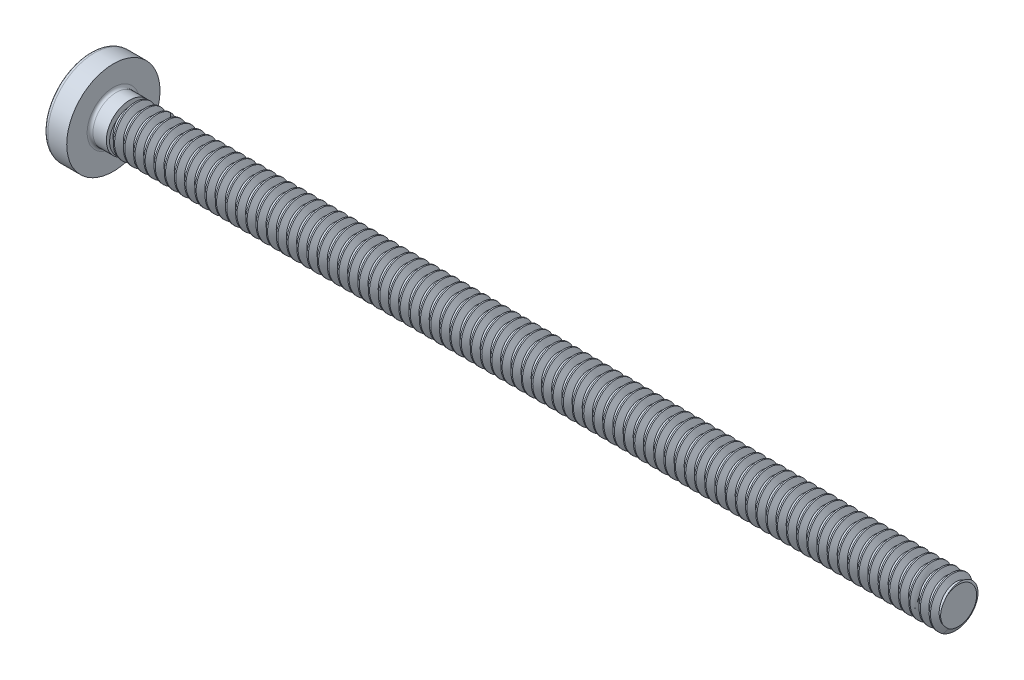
SolidWorks part; units mm, degrees
ref_plane "Front Plane" through (0, 0, 0) normal (0, 0, 1) x (1, 0, 0)
ref_plane "Top Plane" through (0, 0, 0) normal (0, 1, 0) x (1, 0, 0)
ref_plane "Right Plane" through (0, 0, 0) normal (1, 0, 0) x (0, 0, -1)
sketch "Sketch2" plane through (0, 0, 0) normal (0, -1, 0) x (1, 0, 0)
  line L0 (0, 0) -> (-30.3, 0)
  line L1 (0, 0) -> (0, 0.8)
  line L2 (0, 0.8) -> (-29, 0.8)
  line L3 (-29, 0.8) -> (-29, 1.6)
  line L4 (-29, 1.6) -> (-29.6493, 1.6)
  line L5 (-2.352, 0) -> (2.352, 0) construction
  arc A0 (-29.6493, 1.6) -> (-29.7674, 1.5426) centre (-29.6493, 1.45) ccw
  arc A1 (-29.7674, 1.5426) -> (-30.3, 0) centre (-27.8, 0) ccw
  point P17 (0, 0)
  dimension "D1" = 1.6
  dimension "D4" = 2.5
  dimension "D5" = 0.15
  dimension "D2" = 3.2
  dimension "D3" = 29
  dimension "D6" = 1.3
revolve "Revolve1" add sketch "Sketch2" angle 360 about L5
fillet "Fillet1" radius 0.1 1 edges at (-29, 0, 0.8)
ref_plane "Plane1" through (-30.3, 0, 0) normal (-1, 0, 0) x (0, 0, 1)
ref_plane "Plane2" through (-29.4, 0, 0) normal (-1, 0, 0) x (0, 0, 1)
sketch "Sketch3" plane through (-30.3, 0, 0) normal (1, 0, 0) x (0, 0, -1)
  line L1 (-0.24, 0.8) -> (0.24, 0.8)
  line L2 (-0.24, 0.8) -> (-0.24, -0.8)
  line L3 (-0.24, -0.8) -> (0.24, -0.8)
  line L4 (0.24, 0.8) -> (0.24, -0.8)
  line L5 (-0.24, 0.8) -> (0.24, -0.8) construction
  line L6 (-0.24, -0.8) -> (0.24, 0.8) construction
  point P0 (0, 0)
  dimension "D1" = 1.6
  dimension "D2" = 0.48
sketch "Sketch4" plane through (-29.4, 0, 0) normal (1, 0, 0) x (0, 0, -1)
  line L1 (0.24, -0.3515) -> (-0.24, -0.3515)
  line L2 (0.24, -0.3515) -> (0.24, 0.3515)
  line L3 (0.24, 0.3515) -> (-0.24, 0.3515)
  line L4 (-0.24, -0.3515) -> (-0.24, 0.3515)
  line L5 (0.24, -0.3515) -> (-0.24, 0.3515) construction
  line L6 (0.24, 0.3515) -> (-0.24, -0.3515) construction
  point P0 (0, 0)
  dimension "D1" = 0.703
  dimension "D2" = 0.48
loft "Cut-Loft1" cut profiles "Sketch3", "Sketch4"
pattern_circular "CirPattern1" count 2 over 90 about axis through (0, 0, 0) along (1, 0, 0) of "Cut-Loft1"
sketch "Sketch5" plane through (0, 0, 0) normal (0, 0, 1) x (1, 0, 0)
  line L0 (-30.3, 0.4184) -> (-30.3, 0)
  line L1 (-30.3, 0) -> (-29.2845, 0)
  line L2 (-29.2845, 0) -> (-29.4, 0.3555)
  line L3 (-29.4, 0.3555) -> (-30.3, 0.4184)
  line L4 (-30.3, 0) -> (-29, 0) construction
  line L5 (-29, -0.9) -> (-29, 0.9) construction
  dimension "D1" = 0.4184
  dimension "D2" = 0.9
  dimension "D3" = 1.3
  dimension "D4" = 4
  dimension "D5" = 18
revolve "Cut-Revolve1" cut sketch "Sketch5" angle 360 about L4
chamfer "Chamfer1" distance 0.175 angle 30 1 edges at (0, 0, 0.8)
thread "Thread1" pitch 0.35 start angle 0, offset 2, length 0, pitch 0.35, diameter 1.6
ref_plane "Plane3" through (1.899, 0, 0.8) normal (0, -1, 0) x (0, 0, 1)
sketch "Thread Profile1" plane through (1.899, 0, 0.8) normal (0, -1, 0) x (0, 0, 1)
  line L0 (0, 0) -> (0, 0.35) construction
  line L11 (0, 0) -> (0, 0.3062)
  line L12 (0, 0.3062) -> (-0.1894, 0.1969)
  line L13 (-0.1894, 0.1969) -> (-0.1894, 0.1094)
  line L15 (-0.1894, 0.1094) -> (0, 0)
  line L17 (-0.1894, 0.1531) -> (0, 0.1531) construction
  point P2 (0, 0)
  dimension "Pitch" = 0.35
  dimension "Profile_Angle" = 60
  dimension "Profile_Land" = 0.0875
  dimension "Profile_Height" = 0.1894
sketch "Sketch8" plane through (-29, 0, 0) normal (1, 0, 0) x (0, 0, -1)
  circle A0 centre (0, 0) radius 0.8
  dimension "D1" = 1.6
extrude "Boss-Extrude1" add sketch "Sketch8" along normal blind 0.56
